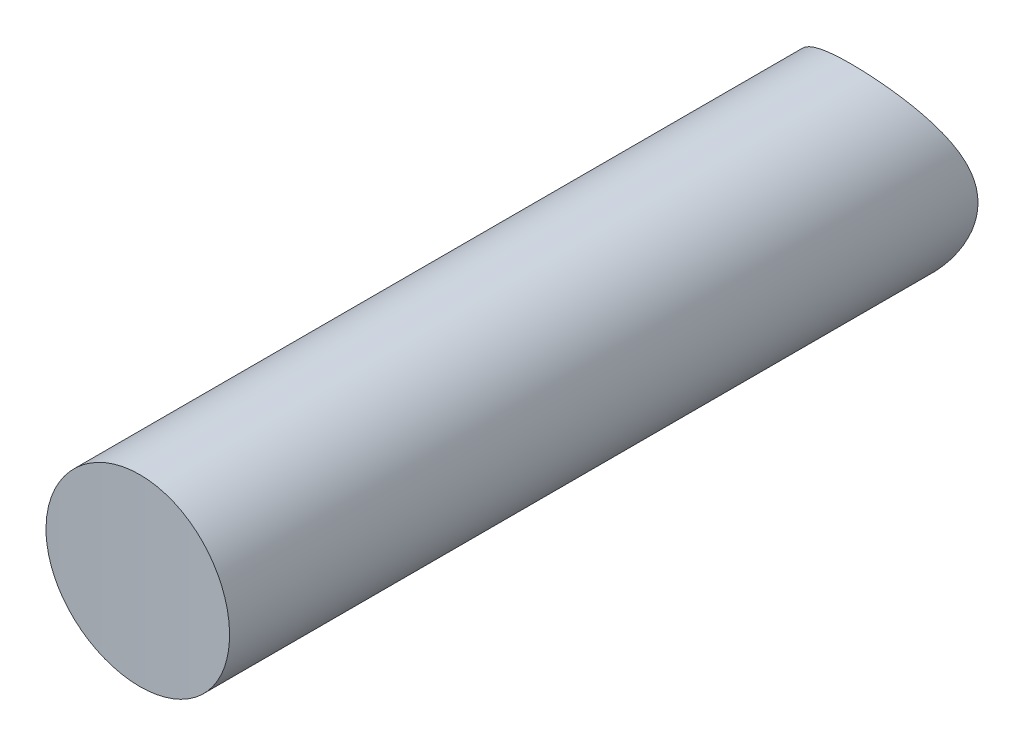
SolidWorks part; units mm, degrees
ref_plane "Plan de face" through (0, 0, 0) normal (0, 0, 1) x (1, 0, 0)
ref_plane "Plan de dessus" through (0, 0, 0) normal (0, 1, 0) x (1, 0, 0)
ref_plane "Plan de droite" through (0, 0, 0) normal (1, 0, 0) x (0, 0, -1)
sketch "Esquisse1" plane through (0, 0, 0) normal (0, 0, 1) x (1, 0, 0)
  circle A0 centre (0, 0) radius 4
  dimension "D1" = 8
extrude "Boss.-Extru.1" add sketch "Esquisse1" along normal blind 70
sketch "Esquisse2" plane through (0, 0, 0) normal (0, 1, 0) x (1, 0, 0)
  circle A0 centre (0, -124) radius 90
  circle A1 centre (0, 3) radius 6
  dimension "D1" = 180
  dimension "D2" = 124
  dimension "D3" = 12
  dimension "D4" = 3
extrude "Enlèv. mat.-Extru.1" cut sketch "Esquisse2" against normal through all and the other way through all
